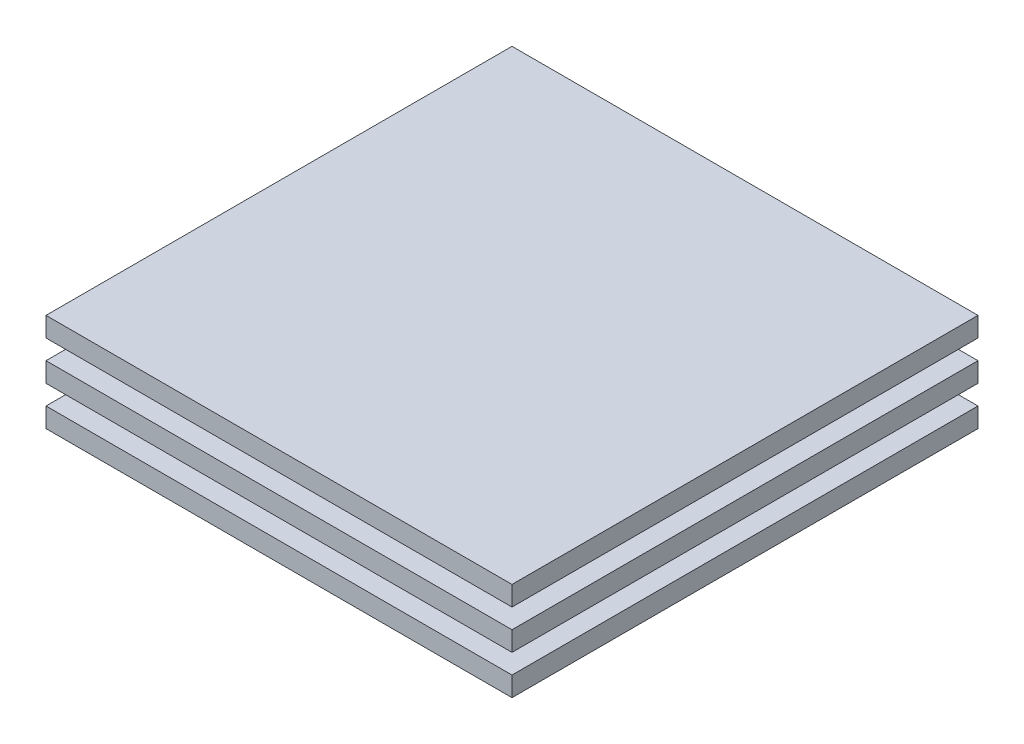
SolidWorks part; units mm, degrees
ref_plane "Front Plane" through (0, 0, 0) normal (0, 0, 1) x (1, 0, 0)
ref_plane "Top Plane" through (0, 0, 0) normal (0, 1, 0) x (1, 0, 0)
ref_plane "Right Plane" through (0, 0, 0) normal (1, 0, 0) x (0, 0, -1)
sketch "Sketch1" plane through (0, 0, 0) normal (0, 1, 0) x (1, 0, 0)
  line L1 (-4.826, 4.826) -> (4.826, 4.826)
  line L2 (-4.826, 4.826) -> (-4.826, -4.826)
  line L3 (-4.826, -4.826) -> (4.826, -4.826)
  line L4 (4.826, 4.826) -> (4.826, -4.826)
  line L5 (-4.826, 4.826) -> (4.826, -4.826) construction
  line L6 (-4.826, -4.826) -> (4.826, 4.826) construction
  point P0 (0, 0)
extrude "Boss-Extrude1" add sketch "Sketch1" along normal blind 0.4064
sketch "Sketch2" plane through (0, 0.4064, 0) normal (0, 1, 0) x (1, 0, 0)
  circle A0 centre (0, 0) radius 4.064
extrude "Boss-Extrude2" add sketch "Sketch2" along normal blind 0.4064
sketch "Sketch3" plane through (0, 0.8128, 0) normal (0, 1, 0) x (1, 0, 0)
  line L1 (-4.826, -4.826) -> (4.826, -4.826)
  line L2 (-4.826, -4.826) -> (-4.826, 4.826)
  line L3 (-4.826, 4.826) -> (4.826, 4.826)
  line L4 (4.826, -4.826) -> (4.826, 4.826)
  line L5 (-4.826, -4.826) -> (4.826, 4.826) construction
  line L6 (-4.826, 4.826) -> (4.826, -4.826) construction
  point P0 (0, 0)
extrude "Boss-Extrude3" add sketch "Sketch3" along normal blind 0.4064
sketch "Sketch4" plane through (0, 1.2192, 0) normal (0, 1, 0) x (1, 0, 0)
  circle A0 centre (0, 0) radius 4.064
extrude "Boss-Extrude4" add sketch "Sketch4" along normal blind 0.4064
sketch "Sketch5" plane through (0, 1.6256, 0) normal (0, 1, 0) x (1, 0, 0)
  line L1 (-4.826, -4.826) -> (4.826, -4.826)
  line L2 (-4.826, -4.826) -> (-4.826, 4.826)
  line L3 (-4.826, 4.826) -> (4.826, 4.826)
  line L4 (4.826, -4.826) -> (4.826, 4.826)
  line L5 (-4.826, -4.826) -> (4.826, 4.826) construction
  line L6 (-4.826, 4.826) -> (4.826, -4.826) construction
  point P0 (0, 0)
extrude "Boss-Extrude5" add sketch "Sketch5" along normal blind 0.4064
